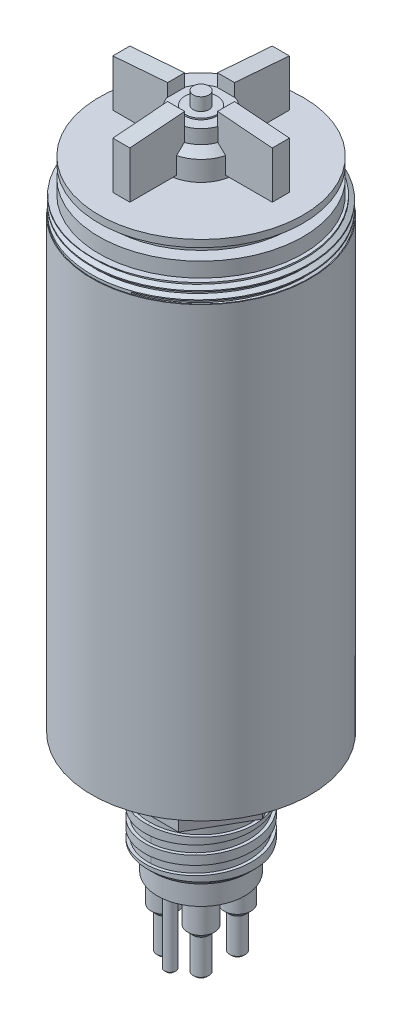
SolidWorks part; units mm, degrees
ref_plane "Front Plane" through (0, 0, 0) normal (0, 0, 1) x (1, 0, 0)
ref_plane "Top Plane" through (0, 0, 0) normal (0, 1, 0) x (1, 0, 0)
ref_plane "Right Plane" through (0, 0, 0) normal (1, 0, 0) x (0, 0, -1)
sketch "Sketch1" plane through (0, 0, 0) normal (0, 0, 1) x (1, 0, 0)
  line L0 (0, 0) -> (0, 40.7512) construction
  line L1 (0, 0) -> (0, -88.9)
  line L2 (0, -88.9) -> (-19.4945, -88.9)
  line L3 (-19.4945, -88.9) -> (-19.4945, -9.144)
  line L4 (-19.4945, -9.144) -> (-19.3675, -9.144)
  line L5 (-19.3675, -9.144) -> (-19.3675, -5.969)
  line L6 (-19.3675, -5.969) -> (-18.1991, -5.969)
  line L7 (-18.1991, -5.969) -> (-18.1991, -3.3528)
  line L8 (-18.1991, 0) -> (0, 0)
  line L9 (-18.1991, -1.27) -> (-18.1991, 0)
  line L10 (-18.1991, -1.27) -> (-15.8496, -1.27)
  line L12 (-18.1991, -3.3528) -> (-15.8496, -3.3528)
  line L13 (-15.8496, -1.27) -> (-15.8496, -3.3528)
  dimension "D1" = 1.27
  dimension "D2" = 2.0828
  dimension "D3" = 5.969
  dimension "D4" = 3.175
  dimension "D5" = 88.9
  dimension "D6" = 38.989
  dimension "D7" = 38.735
  dimension "D8" = 36.3982
  dimension "D9" = 31.6992
revolve "Revolve1" add sketch "Sketch1" angle 360 about L0
sketch "Sketch4" plane through (0, 0, 0) normal (0, 0, 1) x (1, 0, 0)
  line L0 (0, 0) -> (0, 38.3414) construction
  line L1 (0, 0) -> (0, 10.16)
  line L2 (0, 10.16) -> (-1.397, 10.16)
  line L3 (-1.397, 10.16) -> (-1.397, 7.874)
  line L4 (-1.397, 7.874) -> (-2.8448, 7.874)
  line L5 (-2.8448, 7.874) -> (-2.8448, 7.62)
  line L6 (-2.8448, 7.62) -> (-4.7625, 7.62)
  line L7 (-4.7625, 7.62) -> (-4.7625, 5.1435)
  line L8 (-4.7625, 5.1435) -> (-6.096, 3.81)
  line L9 (-6.096, 3.81) -> (-6.096, 0.254)
  line L10 (-6.096, 0.254) -> (-1.397, 0.254)
  line L11 (-1.397, 0.254) -> (-1.397, 0)
  line L12 (18.1991, 0) -> (-18.1991, 0) construction
  line L13 (-1.397, 0) -> (0, 0)
other "AlignGroup1" parameters "D1"=2.5797, "D2"=7.9533, "D3"=8.4784, "D4"=16.2879, "D5"=9.525, "D6"=0, "D7"=0.254, "D8"=3.81, "D9"=7.62, "D10"=7.874, "D11"=10.16
revolve "Revolve2" add sketch "Sketch4" angle 360 about L0
sketch "Sketch5" plane through (0, 0, 0) normal (0, 0, 1) x (1, 0, 0)
  line L0 (18.1991, 0) -> (-18.1991, 0) construction
  line L1 (4.445, 9.906) -> (14.224, 9.144)
  line L2 (4.445, 9.906) -> (4.445, 0.762)
  line L3 (4.445, 0.762) -> (14.224, 0.762)
  line L4 (14.224, 9.144) -> (14.224, 0.762)
  dimension "D1" = 4.445
  dimension "D2" = 0.762
  dimension "D3" = 9.779
  dimension "D4" = 9.906
  dimension "D5" = 9.144
extrude "Boss-Extrude3" add sketch "Sketch5" along normal mid plane 3.048
pattern_circular "CirPattern1" count 4 over 360 about axis through (0, 0, 0) along (0, 1, 0) of "Boss-Extrude3"
inserted part "mcbh4m"
move or copy body "Body-Move/Copy2" placed by mates yes
thread "Thread1" pitch 1.4111 start angle 0, offset 1, length 3.81, pitch 1.4111, diameter 38.735
ref_plane "Plane1" through (-19.3675, -4.969, 0) normal (0, 0, 1) x (-1, 0, 0)
sketch "Thread Profile1" plane through (-19.3675, -4.969, 0) normal (0, 0, 1) x (-1, 0, 0)
  line L0 (0, 0) -> (0, 1.4111) construction
  line L11 (0, 0) -> (0, 1.2347)
  line L12 (0, 1.2347) -> (-0.7638, 0.7937)
  line L13 (-0.7638, 0.7937) -> (-0.7638, 0.441)
  line L15 (-0.7638, 0.441) -> (0, 0)
  line L17 (-0.7638, 0.6174) -> (0, 0.6174) construction
  point P2 (0, 0)
  dimension "Pitch" = 1.4111
  dimension "Profile_Angle" = 60
  dimension "Profile_Land" = 0.3528
  dimension "Profile_Height" = 0.7638
sketch "Sketch6" [suppressed] plane through (0, 0, 0) normal (0, 0, 1) x (1, 0, 0)
  line L0 (-18.415, -9.144) -> (-21.0843, -9.144)
  line L1 (-21.59, -8.5879) -> (-19.3675, 14.7805)
  line L2 (-18.8824, 15.24) -> (-6.35, 15.748)
  line L3 (-6.35, 15.748) -> (-6.35, 19.812)
  line L4 (-6.35, 19.812) -> (-6.985, 19.812)
  line L5 (-6.985, 19.812) -> (-6.35, 23.5373)
  line L6 (-6.35, 23.5373) -> (-6.985, 23.5373)
  line L7 (-6.985, 23.5373) -> (-6.35, 27.2627)
  line L8 (-6.35, 27.2627) -> (-6.985, 27.2627)
  line L9 (-6.985, 27.2627) -> (-6.35, 30.988)
  line L10 (-6.35, 30.988) -> (-5.08, 30.988)
  line L11 (-5.08, 30.988) -> (-5.08, 12.8016)
  line L12 (-5.08, 12.8016) -> (-17.272, 12.3952)
  line L13 (-17.272, 12.3952) -> (-17.272, 0)
  line L15 (-17.272, 0) -> (-18.415, 0)
  line L16 (-18.415, 0) -> (-18.415, -9.144)
  line L17 (0, 0) -> (0, 20.5658) construction
  arc A0 (-19.3675, 14.7805) -> (-18.8824, 15.24) centre (-18.8618, 14.7324) cw
  arc A1 (-21.0843, -9.144) -> (-21.59, -8.5879) centre (-21.0843, -8.636) cw
  dimension "D1" = 0.508
  dimension "D2" = 12.7
  dimension "D3" = 13.97
  dimension "D4" = 10.16
  dimension "D5" = 43.18
  dimension "D6" = 38.735
  dimension "D7" = 34.544
  dimension "D8" = 24.384
  dimension "D9" = 24.892
  dimension "D10" = 21.5392
  dimension "D11" = 21.9456
  dimension "D12" = 4.064
  dimension "D13" = 15.24
  dimension "D14" = 36.83
  dimension "D15" = 9.144
revolve "Revolve3" [suppressed] add sketch "Sketch6" angle 360 about L17
ref_plane "Plane2" [suppressed] through (0, 0, 11.43) normal (0, 0, 1) x (1, 0, 0)
sketch "Sketch7" [suppressed] plane through (0, 0, 11.43) normal (0, 0, 1) x (1, 0, 0)
  line L0 (-8.6819, 6.096) -> (-42.5999, 6.096) construction
  line L1 (-19.4945, -9.144) -> (19.4945, -9.144) construction
  line L2 (-17.78, 11.176) -> (-38.1, 11.176)
  line L3 (-38.1, 11.176) -> (-38.1, 12.446)
  line L4 (-38.1, 12.446) -> (-34.29, 13.081)
  line L5 (-34.29, 13.081) -> (-34.29, 12.446)
  line L6 (-34.29, 12.446) -> (-30.48, 13.081)
  line L7 (-30.48, 13.081) -> (-30.48, 12.446)
  line L8 (-30.48, 12.446) -> (-26.67, 13.081)
  line L9 (-26.67, 13.081) -> (-26.67, 12.446)
  line L10 (-26.67, 12.446) -> (-17.78, 12.446)
  line L11 (-17.78, 12.446) -> (-17.78, 11.176)
  dimension "D1" = 15.24
  dimension "D2" = 10.16
  dimension "D3" = 12.7
  dimension "D4" = 13.97
  dimension "D5" = 38.1
  dimension "D6" = 11.43
  dimension "D7" = 17.78
revolve "Revolve4" [suppressed] add sketch "Sketch7" angle 360 about L0
sketch "Sketch8" [suppressed] plane through (-17.78, 0, 0) normal (1, 0, 0) x (0, 0, -1)
  arc A4 (-8.3965, 11.6746) -> (-8.6832, 10.3694) centre (219.7725, -39.1323) ccw
  arc A5 (-8.3965, 11.6746) -> (-10.783, -0.2209) centre (-11.43, 6.096) ccw
  arc A6 (-10.5397, 1.0946) -> (-10.783, -0.2209) centre (427.61, -80.6181) ccw
  arc A7 (-8.6832, 10.3694) -> (-10.5397, 1.0946) centre (-11.43, 6.096) ccw
  arc A8 (-8.3965, 11.6746) -> (-8.6832, 10.3694) centre (219.7725, -39.1323) ccw
  arc A9 (-8.3965, 11.6746) -> (-10.783, -0.2209) centre (-11.43, 6.096) ccw
  arc A10 (-10.5397, 1.0946) -> (-10.783, -0.2209) centre (427.61, -80.6181) ccw
  arc A11 (-8.6832, 10.3694) -> (-10.5397, 1.0946) centre (-11.43, 6.096) ccw
  dimension "D1" = 0
extrude "Boss-Extrude4" [suppressed] add sketch "Sketch8" along normal up to next
sketch "Sketch9" [suppressed] plane through (-38.1, 0, 0) normal (-1, 0, 0) x (0, 0, 1)
  circle A0 centre (11.43, 6.096) radius 5.08 construction
  circle A1 centre (11.43, 6.096) radius 5.08
extrude "Cut-Extrude1" [suppressed] cut sketch "Sketch9" against normal up to surface (25.151 mm away)
